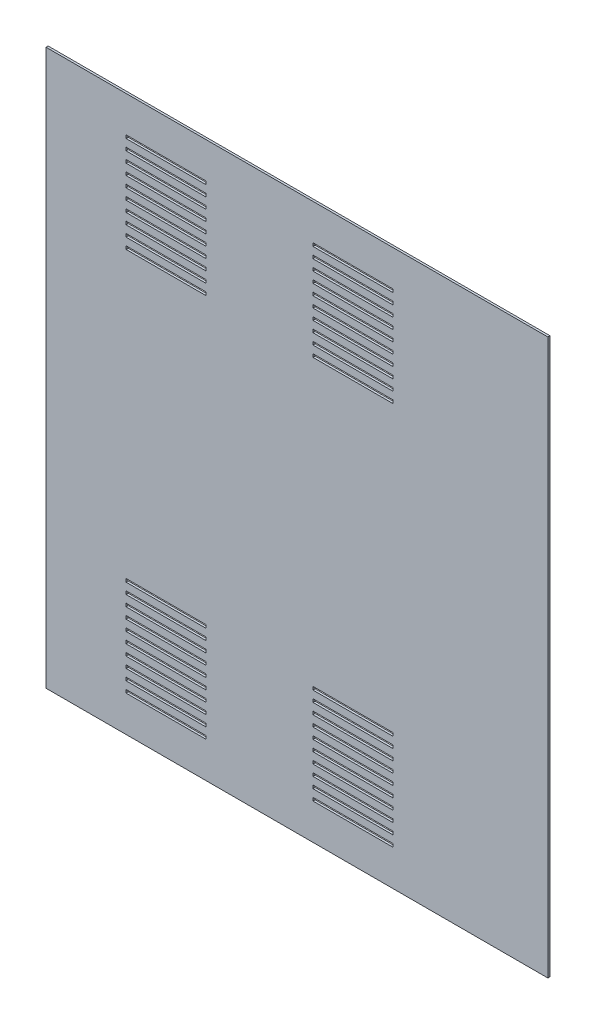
SolidWorks part; units mm, degrees
ref_plane "前视基准面" through (0, 0, 0) normal (0, 0, 1) x (1, 0, 0)
ref_plane "上视基准面" through (0, 0, 0) normal (0, 1, 0) x (1, 0, 0)
ref_plane "右视基准面" through (0, 0, 0) normal (1, 0, 0) x (0, 0, -1)
sketch "草图1" plane through (0, 0, 0) normal (0, 0, 1) x (1, 0, 0)
  line L0 (440, 40) -> (440, 560) construction
  line L1 (40, 560) -> (440, 560)
  line L2 (40, 560) -> (40, 40)
  line L3 (40, 40) -> (440, 40)
  line L4 (440, 560) -> (440, 40)
  line L5 (240, 560) -> (240, 40) construction
  line L6 (365, 523.4388) -> (290, 523.4388)
  line L7 (115, 526.4388) -> (190, 526.4388)
  line L8 (115, 526.4388) -> (115, 523.4388)
  line L9 (115, 523.4388) -> (190, 523.4388)
  line L10 (190, 526.4388) -> (190, 523.4388)
  line L11 (365, 526.4388) -> (290, 526.4388)
  line L12 (365, 526.4388) -> (365, 523.4388)
  line L13 (290, 526.4388) -> (290, 523.4388)
  line L14 (115, 516.4388) -> (190, 516.4388)
  line L15 (115, 513.4388) -> (190, 513.4388)
  line L16 (115, 516.4388) -> (115, 513.4388)
  line L17 (190, 516.4388) -> (190, 513.4388)
  line L18 (365, 516.4388) -> (365, 513.4388)
  line L19 (365, 516.4388) -> (290, 516.4388)
  line L20 (365, 513.4388) -> (290, 513.4388)
  line L21 (290, 516.4388) -> (290, 513.4388)
  line L22 (115, 506.4388) -> (190, 506.4388)
  line L23 (115, 503.4388) -> (190, 503.4388)
  line L24 (115, 506.4388) -> (115, 503.4388)
  line L25 (190, 506.4388) -> (190, 503.4388)
  line L26 (365, 506.4388) -> (365, 503.4388)
  line L27 (365, 506.4388) -> (290, 506.4388)
  line L28 (365, 503.4388) -> (290, 503.4388)
  line L29 (290, 506.4388) -> (290, 503.4388)
  line L30 (115, 496.4388) -> (190, 496.4388)
  line L31 (115, 493.4388) -> (190, 493.4388)
  line L32 (115, 496.4388) -> (115, 493.4388)
  line L33 (190, 496.4388) -> (190, 493.4388)
  line L34 (365, 496.4388) -> (365, 493.4388)
  line L35 (365, 496.4388) -> (290, 496.4388)
  line L36 (365, 493.4388) -> (290, 493.4388)
  line L37 (290, 496.4388) -> (290, 493.4388)
  line L38 (115, 486.4388) -> (190, 486.4388)
  line L39 (115, 483.4388) -> (190, 483.4388)
  line L40 (115, 486.4388) -> (115, 483.4388)
  line L41 (190, 486.4388) -> (190, 483.4388)
  line L42 (365, 486.4388) -> (365, 483.4388)
  line L43 (365, 486.4388) -> (290, 486.4388)
  line L44 (365, 483.4388) -> (290, 483.4388)
  line L45 (290, 486.4388) -> (290, 483.4388)
  line L46 (115, 476.4388) -> (190, 476.4388)
  line L47 (115, 473.4388) -> (190, 473.4388)
  line L48 (115, 476.4388) -> (115, 473.4388)
  line L49 (190, 476.4388) -> (190, 473.4388)
  line L50 (365, 476.4388) -> (365, 473.4388)
  line L51 (365, 476.4388) -> (290, 476.4388)
  line L52 (365, 473.4388) -> (290, 473.4388)
  line L53 (290, 476.4388) -> (290, 473.4388)
  line L54 (115, 466.4388) -> (190, 466.4388)
  line L55 (115, 463.4388) -> (190, 463.4388)
  line L56 (115, 466.4388) -> (115, 463.4388)
  line L57 (190, 466.4388) -> (190, 463.4388)
  line L58 (365, 466.4388) -> (365, 463.4388)
  line L59 (365, 466.4388) -> (290, 466.4388)
  line L60 (365, 463.4388) -> (290, 463.4388)
  line L61 (290, 466.4388) -> (290, 463.4388)
  line L62 (115, 456.4388) -> (190, 456.4388)
  line L63 (115, 453.4388) -> (190, 453.4388)
  line L64 (115, 456.4388) -> (115, 453.4388)
  line L65 (190, 456.4388) -> (190, 453.4388)
  line L66 (365, 456.4388) -> (365, 453.4388)
  line L67 (365, 456.4388) -> (290, 456.4388)
  line L68 (365, 453.4388) -> (290, 453.4388)
  line L69 (290, 456.4388) -> (290, 453.4388)
  line L70 (115, 446.4388) -> (190, 446.4388)
  line L71 (115, 443.4388) -> (190, 443.4388)
  line L72 (115, 446.4388) -> (115, 443.4388)
  line L73 (190, 446.4388) -> (190, 443.4388)
  line L74 (365, 446.4388) -> (365, 443.4388)
  line L75 (365, 446.4388) -> (290, 446.4388)
  line L76 (365, 443.4388) -> (290, 443.4388)
  line L77 (290, 446.4388) -> (290, 443.4388)
  line L78 (115, 436.4388) -> (190, 436.4388)
  line L79 (115, 433.4388) -> (190, 433.4388)
  line L80 (115, 436.4388) -> (115, 433.4388)
  line L81 (190, 436.4388) -> (190, 433.4388)
  line L82 (365, 436.4388) -> (365, 433.4388)
  line L83 (365, 436.4388) -> (290, 436.4388)
  line L84 (365, 433.4388) -> (290, 433.4388)
  line L85 (290, 436.4388) -> (290, 433.4388)
  line L86 (40, 300) -> (440, 300) construction
  line L87 (290, 163.5612) -> (290, 166.5612)
  line L88 (365, 166.5612) -> (290, 166.5612)
  line L89 (365, 163.5612) -> (290, 163.5612)
  line L90 (365, 163.5612) -> (365, 166.5612)
  line L91 (190, 163.5612) -> (190, 166.5612)
  line L92 (115, 163.5612) -> (115, 166.5612)
  line L93 (115, 166.5612) -> (190, 166.5612)
  line L94 (115, 163.5612) -> (190, 163.5612)
  line L95 (290, 153.5612) -> (290, 156.5612)
  line L96 (365, 156.5612) -> (290, 156.5612)
  line L97 (365, 153.5612) -> (290, 153.5612)
  line L98 (365, 153.5612) -> (365, 156.5612)
  line L99 (190, 153.5612) -> (190, 156.5612)
  line L100 (115, 153.5612) -> (115, 156.5612)
  line L101 (115, 156.5612) -> (190, 156.5612)
  line L102 (115, 153.5612) -> (190, 153.5612)
  line L103 (290, 143.5612) -> (290, 146.5612)
  line L104 (365, 146.5612) -> (290, 146.5612)
  line L105 (365, 143.5612) -> (290, 143.5612)
  line L106 (365, 143.5612) -> (365, 146.5612)
  line L107 (190, 143.5612) -> (190, 146.5612)
  line L108 (115, 143.5612) -> (115, 146.5612)
  line L109 (115, 146.5612) -> (190, 146.5612)
  line L110 (115, 143.5612) -> (190, 143.5612)
  line L111 (290, 133.5612) -> (290, 136.5612)
  line L112 (365, 136.5612) -> (290, 136.5612)
  line L113 (365, 133.5612) -> (290, 133.5612)
  line L114 (365, 133.5612) -> (365, 136.5612)
  line L115 (190, 133.5612) -> (190, 136.5612)
  line L116 (115, 133.5612) -> (115, 136.5612)
  line L117 (115, 136.5612) -> (190, 136.5612)
  line L118 (115, 133.5612) -> (190, 133.5612)
  line L119 (290, 123.5612) -> (290, 126.5612)
  line L120 (365, 126.5612) -> (290, 126.5612)
  line L121 (365, 123.5612) -> (290, 123.5612)
  line L122 (365, 123.5612) -> (365, 126.5612)
  line L123 (190, 123.5612) -> (190, 126.5612)
  line L124 (115, 123.5612) -> (115, 126.5612)
  line L125 (115, 126.5612) -> (190, 126.5612)
  line L126 (115, 123.5612) -> (190, 123.5612)
  line L127 (290, 113.5612) -> (290, 116.5612)
  line L128 (365, 116.5612) -> (290, 116.5612)
  line L129 (365, 113.5612) -> (290, 113.5612)
  line L130 (365, 113.5612) -> (365, 116.5612)
  line L131 (190, 113.5612) -> (190, 116.5612)
  line L132 (115, 113.5612) -> (115, 116.5612)
  line L133 (115, 116.5612) -> (190, 116.5612)
  line L134 (115, 113.5612) -> (190, 113.5612)
  line L135 (290, 103.5612) -> (290, 106.5612)
  line L136 (365, 106.5612) -> (290, 106.5612)
  line L137 (365, 103.5612) -> (290, 103.5612)
  line L138 (365, 103.5612) -> (365, 106.5612)
  line L139 (190, 103.5612) -> (190, 106.5612)
  line L140 (115, 103.5612) -> (115, 106.5612)
  line L141 (115, 106.5612) -> (190, 106.5612)
  line L142 (115, 103.5612) -> (190, 103.5612)
  line L143 (290, 93.5612) -> (290, 96.5612)
  line L144 (365, 96.5612) -> (290, 96.5612)
  line L145 (365, 93.5612) -> (290, 93.5612)
  line L146 (365, 93.5612) -> (365, 96.5612)
  line L147 (190, 93.5612) -> (190, 96.5612)
  line L148 (115, 93.5612) -> (115, 96.5612)
  line L149 (115, 96.5612) -> (190, 96.5612)
  line L150 (115, 93.5612) -> (190, 93.5612)
  line L151 (290, 83.5612) -> (290, 86.5612)
  line L152 (365, 86.5612) -> (290, 86.5612)
  line L153 (365, 83.5612) -> (290, 83.5612)
  line L154 (365, 83.5612) -> (365, 86.5612)
  line L155 (190, 83.5612) -> (190, 86.5612)
  line L156 (115, 83.5612) -> (115, 86.5612)
  line L157 (115, 86.5612) -> (190, 86.5612)
  line L158 (115, 83.5612) -> (190, 83.5612)
  line L159 (290, 73.5612) -> (290, 76.5612)
  line L160 (365, 73.5612) -> (365, 76.5612)
  line L161 (365, 73.5612) -> (290, 73.5612)
  line L162 (190, 73.5612) -> (190, 76.5612)
  line L163 (115, 76.5612) -> (190, 76.5612)
  line L164 (115, 73.5612) -> (115, 76.5612)
  line L165 (115, 73.5612) -> (190, 73.5612)
  line L166 (365, 76.5612) -> (290, 76.5612)
  dimension "D1" = 3
  dimension "D2" = 75
  dimension "D4" = 50
  dimension "D3" = 10
extrude "凸台-拉伸1" add sketch "草图1" against normal blind 2
other "移动面1" parameters "D1"=70
